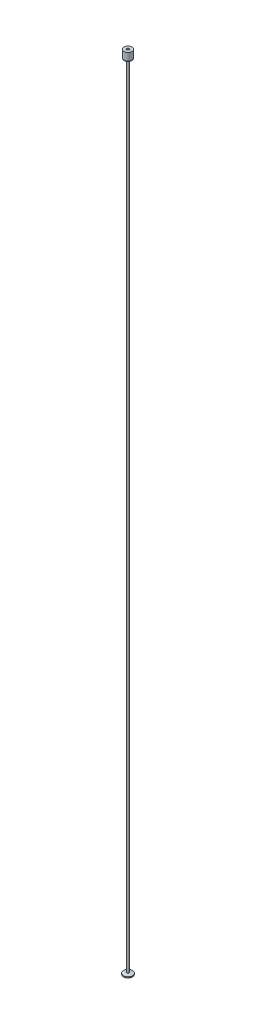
SolidWorks part; units mm, degrees
ref_plane "Płaszczyzna przednia" through (0, 0, 0) normal (0, 0, 1) x (1, 0, 0)
ref_plane "Płaszczyzna górna" through (0, 0, 0) normal (0, 1, 0) x (1, 0, 0)
ref_plane "Płaszczyzna prawa" through (0, 0, 0) normal (1, 0, 0) x (0, 0, -1)
sketch "Szkic1" plane through (0, 0, 0) normal (0, 1, 0) x (1, 0, 0)
  circle A0 centre (0, 0) radius 6.9
  dimension "D1" = 13.8
extrude "Dodanie-wyciągnięcie1" add sketch "Szkic1" along normal blind 2.5
chamfer "Sfazowanie1" distance 5 angle 10 1 edges at (0, 2.5, 6.9)
sketch "Szkic2" plane through (0, 2.5, 0) normal (0, 1, 0) x (1, 0, 0)
  circle A0 centre (0, 0) radius 1.5
  dimension "D1" = 3
extrude "Dodanie-wyciągnięcie2" add sketch "Szkic2" along normal blind 1200
sketch "Szkic3" plane through (0, 1202.5, 0) normal (0, 1, 0) x (1, 0, 0)
  circle A0 centre (0, 0) radius 6
  circle A1 centre (0, 0) radius 1.9
  dimension "D1" = 12
extrude "Dodanie-wyciągnięcie3" add sketch "Szkic3" along normal blind 13 from offset 1 separate body
fillet "Zaokrąglenie1" radius 2 1 edges at (0, 1201.5, 6)
